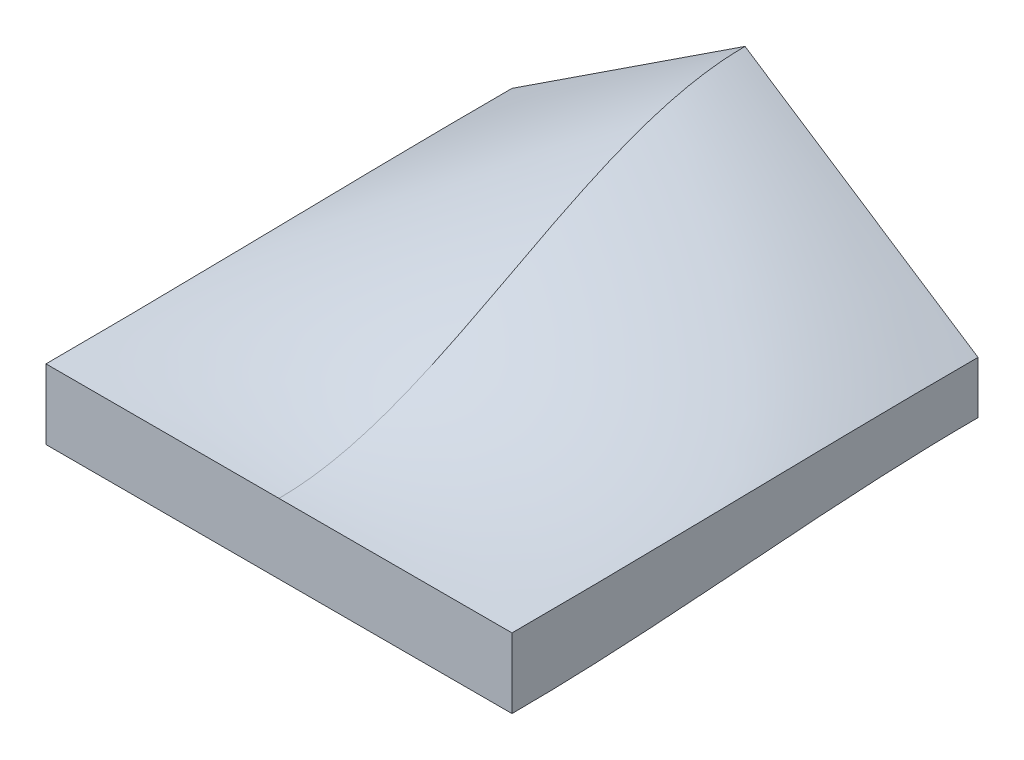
SolidWorks part; units mm, degrees
ref_plane "Front Plane" through (0, 0, 0) normal (0, 0, 1) x (1, 0, 0)
ref_plane "Top Plane" through (0, 0, 0) normal (0, 1, 0) x (1, 0, 0)
ref_plane "Right Plane" through (0, 0, 0) normal (1, 0, 0) x (0, 0, -1)
ref_plane "Plane1" through (0, 0, -50) normal (0, 0, 1) x (1, 0, 0)
sketch "Sketch1" plane through (0, 0, 0) normal (0, 0, 1) x (1, 0, 0)
  line L0 (0, 0) -> (25, 0)
  line L1 (-25, 0) -> (0, 0)
  line L2 (-25, 0) -> (-25, -7.5)
  line L3 (-25, -7.5) -> (25, -7.5)
  line L4 (25, 0) -> (25, -7.5)
  dimension "D1" = 50
  dimension "D2" = 7.5
sketch "Sketch2" plane through (-0.3242, -11.7465, -50) normal (0, 0, 1) x (1, 0, 0)
  line L0 (0.3242, 28.7465) -> (25.3242, 12.3465)
  line L1 (-24.6758, 12.3465) -> (0.3242, 28.7465)
  line L2 (-24.6758, 12.3465) -> (-24.6758, 6.7465)
  line L3 (-24.6758, 6.7465) -> (25.3242, 6.7465)
  line L4 (25.3242, 12.3465) -> (25.3242, 6.7465)
  dimension "D1" = 50
  dimension "D2" = 5
  dimension "D4" = 22
  dimension "D5" = 5.6
loft "Loft1" add profiles "Sketch1", "Sketch2"
